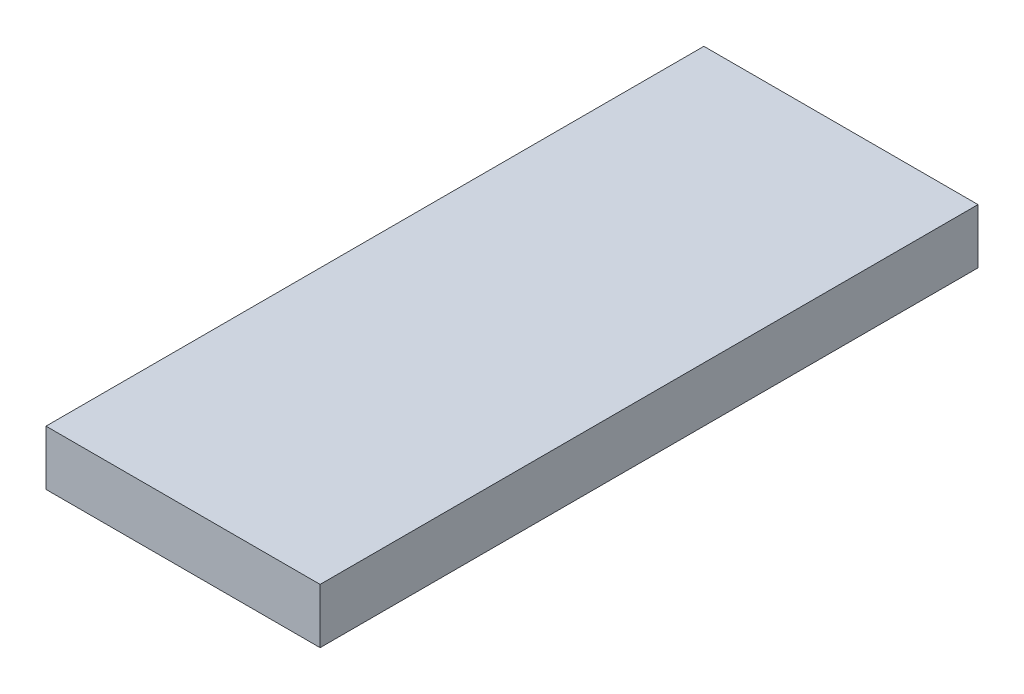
SolidWorks part; units mm, degrees
ref_plane "Plan de face" through (0, 0, 0) normal (0, 0, 1) x (1, 0, 0)
ref_plane "Plan de dessus" through (0, 0, 0) normal (0, 1, 0) x (1, 0, 0)
ref_plane "Plan de droite" through (0, 0, 0) normal (1, 0, 0) x (0, 0, -1)
sketch "Esquisse1" plane through (0, 0, 0) normal (0, 0, 1) x (1, 0, 0)
  line L1 (12.5, -2.5) -> (-12.5, -2.5)
  line L2 (12.5, -2.5) -> (12.5, 2.5)
  line L3 (12.5, 2.5) -> (-12.5, 2.5)
  line L4 (-12.5, -2.5) -> (-12.5, 2.5)
  line L5 (12.5, -2.5) -> (-12.5, 2.5) construction
  line L6 (12.5, 2.5) -> (-12.5, -2.5) construction
  point P0 (0, 0)
  dimension "D1" = 25
  dimension "D2" = 5
extrude "Boss.-Extru.1" add sketch "Esquisse1" along normal blind 60
